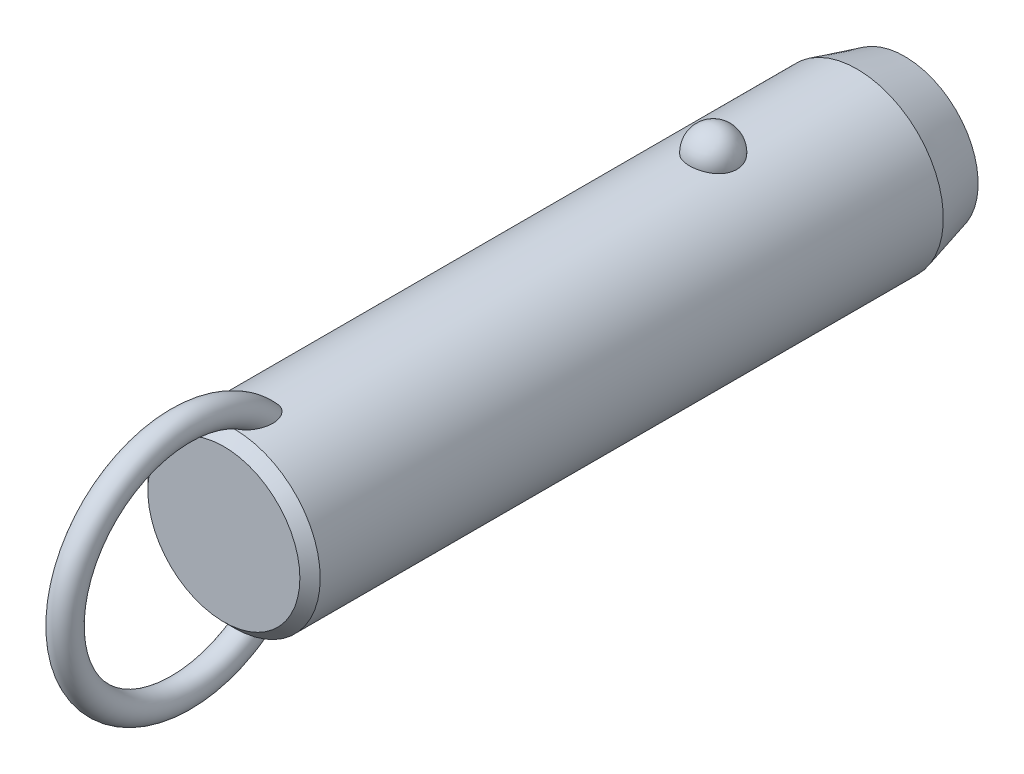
SolidWorks part; units mm, degrees
ref_plane "Front Plane" through (0, 0, 0) normal (0, 0, 1) x (1, 0, 0)
ref_plane "Top Plane" through (0, 0, 0) normal (0, 1, 0) x (1, 0, 0)
ref_plane "Right Plane" through (0, 0, 0) normal (1, 0, 0) x (0, 0, -1)
sketch "Sketch2" plane through (0, 0, 0) normal (0, 0, 1) x (1, 0, 0)
  circle A0 centre (0, 0) radius 12.7
  point P3 (0, 12.7)
  dimension "D1" = 25.4
extrude "Boss-Extrude1" add sketch "Sketch2" along normal blind 55.9
sketch "Sketch3" plane through (0, 0, 0) normal (0, 0, -1) x (-1, 0, 0)
  circle A0 centre (0, 0) radius 12.7
  dimension "D1" = 25.4
extrude "Boss-Extrude2" add sketch "Sketch3" along normal blind 31.7
chamfer "Chamfer1" distance 7 angle 15 1 edges at (-12.7, 0, -31.7)
sketch "Sketch12" plane through (0, 0, 0) normal (1, 0, 0) x (0, 0, -1)
  line L0 (-55.9, 12.7) -> (-55.9, -12.7) construction
  point P0 (-55.9, 0)
sketch "Sketch13" plane through (0, 0, 0) normal (1, 0, 0) x (0, 0, -1)
  circle A0 centre (-74.95, 0) radius 19.05
  point P2 (-55.9, 0)
  dimension "D1" = 38.1
sketch "Sketch14" plane through (0, 0, 0) normal (0, 1, 0) x (1, 0, 0)
  circle A0 centre (0, -57.9) radius 2
  point P2 (0, -55.9)
  dimension "D1" = 4
sweep "Sweep1" add profiles "Sketch14" path "Sketch13"
sketch "Sketch15" plane through (0, 0, 55.9) normal (0, 0, 1) x (1, 0, 0)
  circle A0 centre (0, 0) radius 12.7
  dimension "D1" = 25.4
extrude "Boss-Extrude3" add sketch "Sketch15" along normal blind 12.7
chamfer "Chamfer2" distance 1.5 angle 45 1 edges at (12.7, 0, 68.6)
sketch "Sketch18" plane through (0, 0, 0) normal (1, 0, 0) x (0, 0, -1)
  line L0 (24.7, 12.7) -> (-60.751, 12.7) construction
  line L1 (3.5, 16.2) -> (3.5, 9.2)
  line L2 (-60.751, -12.7) -> (24.7, -12.7) construction
  arc A0 (3.5, 16.2) -> (3.5, 9.2) centre (3.5, 12.7) ccw
  point P4 (0, 12.7)
  dimension "D1" = 28.9
revolve "Revolve1" add sketch "Sketch18" angle 360 about L1
